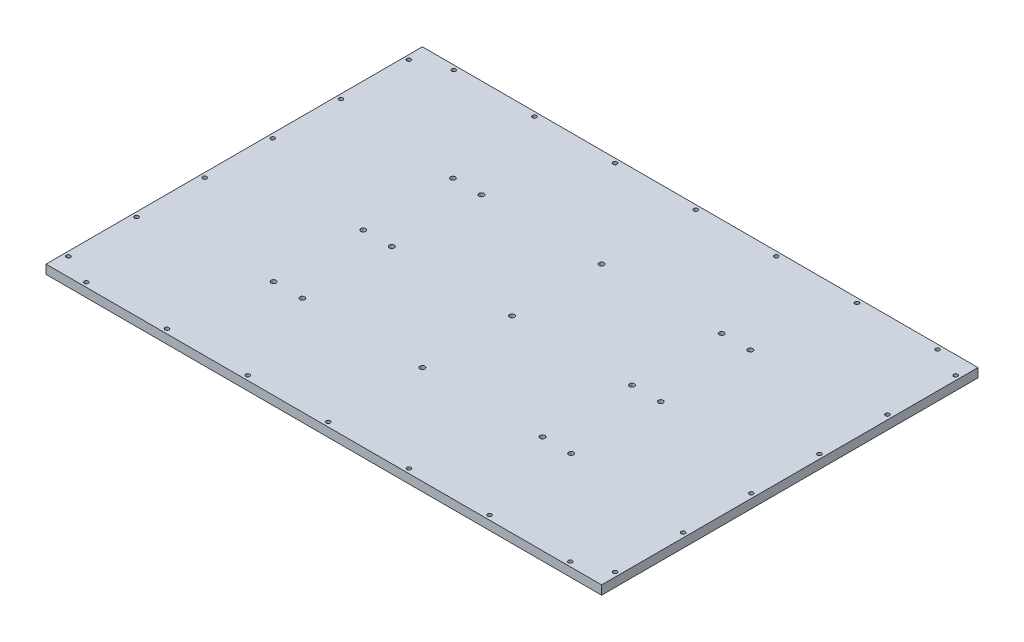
SolidWorks part; units mm, degrees
ref_plane "Спереди" through (0, 0, 0) normal (0, 0, 1) x (1, 0, 0)
ref_plane "Сверху" through (0, 0, 0) normal (0, 1, 0) x (1, 0, 0)
ref_plane "Справа" through (0, 0, 0) normal (1, 0, 0) x (0, 0, -1)
sketch "Эскиз1" plane through (0, 0, 0) normal (0, 1, 0) x (1, 0, 0)
  line L1 (310, 210) -> (-310, 210)
  line L2 (310, 210) -> (310, -210)
  line L3 (310, -210) -> (-310, -210)
  line L4 (-310, 210) -> (-310, -210)
  point P0 (0, 0)
  point P6 (0, 210)
  point P7 (-310, 0)
  dimension "D1" = 620
  dimension "D2" = 420
extrude "Бобышка-Вытянуть1" add sketch "Эскиз1" along normal blind 10
sketch "Эскиз5" plane through (0, 0, 0) normal (0, -1, 0) x (1, 0, 0)
  line L0 (-300, 200) -> (300, 200) construction
  line L5 (-300, 200) -> (-300, -200) construction
  line L7 (300, 200) -> (300, -200) construction
  line L8 (-300, -200) -> (300.0084, -200) construction
  line L10 (-300, 108) -> (300, 108) construction
  line L11 (-300, 108) -> (-300, 92) construction
  line L12 (-300, 92) -> (300, 92) construction
  line L13 (300, 108) -> (300, 92) construction
  line L14 (-300, -92) -> (300, -92) construction
  line L15 (-300, -92) -> (-300, -108) construction
  line L16 (-300, -108) -> (300, -108) construction
  line L17 (300, -92) -> (300, -108) construction
  line L18 (300, 0) -> (-300, 0) construction
  arc A0 (100, -108) -> (100, 108) centre (100, 0) ccw construction
  arc A1 (-126, -108) -> (-192, -200) centre (-100.0756, -196.2719) ccw construction
  arc A2 (-126, -92) -> (-208, -200) centre (-100.0464, -196.8352) ccw construction
  arc A3 (100, -92) -> (100, 92) centre (100, 0) ccw construction
  arc A4 (-126, 92) -> (-208, 200) centre (-100.0464, 196.8352) cw construction
  arc A5 (-126, 108) -> (-192, 200) centre (-100.0756, 196.2719) cw construction
  point P39 (208, 0)
  point P43 (192, 0)
  dimension "D9" = 92
  dimension "D13" = 108
  dimension "D10" = 108
  dimension "D12" = 92
  dimension "D14" = 92
  dimension "D11" = 108
  dimension "D2" = 92
  dimension "D3" = 184
  dimension "D4" = 400
  dimension "D5" = 174
  dimension "D15" = 92
other "Выровнять группу2"
other "Выровнять группу3"
hole_wizard "Отверстие с зазором M41" positions "Эскиз8" profile "Эскиз9" hole size "M4" standard "ISO"
sketch "Эскиз8" plane through (1.473, -10, 2.9376) normal (0, -1, 0) x (1, 0, 0)
  line L0 (308.527, 207.0624) -> (308.527, -212.9376) construction
  line L1 (-311.473, 207.0624) -> (308.527, 207.0624) construction
  line L2 (-311.473, -212.9376) -> (-311.473, 207.0624) construction
  point P0 (303.527, 187.0624)
  point P3 (303.527, 111.0624)
  point P6 (303.527, 35.0624)
  point P9 (303.527, -40.9376)
  point P16 (178.527, 202.0624)
  point P19 (88.527, 202.0624)
  point P22 (-1.473, 202.0624)
  point P25 (-91.473, 202.0624)
  point P30 (268.527, 202.0624)
  point P33 (-181.473, 202.0624)
  point P36 (-271.473, 202.0624)
  point P39 (-306.473, 187.0624)
  point P42 (-306.473, 111.0624)
  point P45 (-306.473, 35.0624)
  point P48 (-306.473, -40.9376)
  point P51 (-306.473, -116.9376)
  point P54 (-306.473, -192.9376)
  point P57 (-271.473, -207.9376)
  point P60 (-181.473, -207.9376)
  point P63 (-91.473, -207.9376)
  point P66 (-1.473, -207.9376)
  point P69 (88.527, -207.9376)
  point P72 (178.527, -207.9376)
  point P75 (268.527, -207.9376)
  point P78 (303.527, -192.9376)
  point P81 (303.527, -116.9376)
  dimension "D1" = 615
  dimension "D2" = 5
  dimension "D3" = 40
  dimension "D4" = 90
  dimension "D5" = 90
  dimension "D6" = 90
  dimension "D7" = 90
  dimension "D8" = 90
  dimension "D9" = 90
  dimension "D10" = 415
  dimension "D11" = 5
  dimension "D12" = 15
  dimension "D13" = 76
  dimension "D14" = 76
  dimension "D15" = 76
  dimension "D16" = 76
  dimension "D17" = 76
  dimension "D18" = 40
  dimension "D19" = 40
sketch "Эскиз9" plane through (305, -10, 190) normal (1, 0, 0) x (0, 0, -1)
  line L0 (0, 0) -> (0, 21.3519)
  line L1 (0, 21.3519) -> (2.25, 20)
  line L2 (2.25, 20) -> (2.25, 0)
  line L3 (2.25, 0) -> (0, 0)
  line L4 (0, 21.3519) -> (-2.25, 20) construction
  line L5 (0, -6.35) -> (0, 107.95) construction
  dimension "Диаметр отверстия" = 4.5
  dimension "Глубина отверстия" = 20
  dimension "Угол заточки сверла" = 118
hole_wizard "Отверстия под штифты Ø8.0 мм1" positions "Эскиз14" profile "Эскиз15" hole size "Ø8.0" standard "ISO"
sketch "Эскиз14" plane through (1.473, -600.0084, -210) normal (0, 0, -1) x (-1, 0, 0)
  line L0 (311.473, 610.0084) -> (311.473, 600.0084) construction
  line L1 (-308.527, 610.0084) -> (-308.527, 600.0084) construction
  point P0 (-148.527, 600.0084)
  point P4 (151.473, 600.0084)
  point P8 (311.473, 605.0084)
  dimension "D1" = 160
  dimension "D2" = 160
  dimension "D3" = 300
sketch "Эскиз15" plane through (150, 0, -210) normal (1, 0, 0) x (0, 1, 0)
  line L0 (0, 0) -> (0, 420)
  line L1 (0, 420) -> (4, 420)
  line L2 (4, 420) -> (4, 0)
  line L3 (4, 0) -> (0, 0)
  line L4 (0, -6.35) -> (0, 107.95) construction
  dimension "Диаметр сквозного отверстия" = 8
  dimension "Глубина сквозного отверстия" = 420
hole_wizard "Цековка для винта с внутренним шестигранником M5" positions "Эскиз20" profile "Эскиз21" hole size "M5" standard "DIN"
sketch "Эскиз20" plane through (1.473, 10, 2.9376) normal (0, 1, 0) x (-1, 0, 0)
  point P0 (167.473, 97.0624)
  point P2 (167.473, -102.9376)
  point P4 (167.473, -2.9376)
  point P8 (-132.527, 97.0624)
  point P10 (-164.527, 97.0624)
  point P12 (-164.527, -102.9376)
  point P14 (-132.527, -102.9376)
  point P45 (135.473, -2.9376)
  point P47 (-132.527, -2.9376)
  point P49 (-164.527, -2.9376)
  point P89 (135.473, -102.9376)
  point P91 (135.473, 97.0624)
  point P97 (1.473, -2.9376)
  point P113 (1.473, 97.0624)
  point P115 (1.473, -102.9376)
sketch "Эскиз21" plane through (-166, 10, 100) normal (1, 0, 0) x (0, 0, 1)
  line L0 (0, 0) -> (0, 11.6524)
  line L1 (0, 11.6524) -> (2.75, 10)
  line L2 (2.75, 10) -> (2.75, 0)
  line L5 (2.75, 0) -> (0, 0)
  line L10 (0, 11.6524) -> (-2.75, 10) construction
  line L11 (0, -6.35) -> (0, 107.95) construction
  dimension "Диаметр отверстия" = 5.5
  dimension "Глубина отверстия" = 10
  dimension "Угол заточки сверла" = 118
